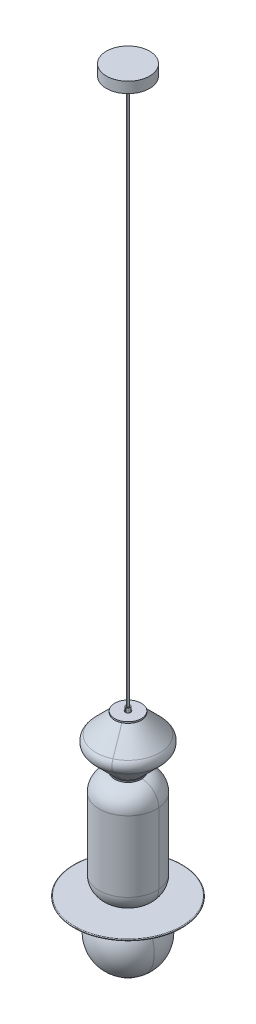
SolidWorks part; units mm, degrees
ref_plane "Alzado" through (0, 0, 0) normal (0, 0, 1) x (1, 0, 0)
ref_plane "Planta" through (0, 0, 0) normal (0, 1, 0) x (1, 0, 0)
ref_plane "Vista lateral" through (0, 0, 0) normal (1, 0, 0) x (0, 0, -1)
imported_body "PAPI_C1233.STEP<1>"
delete or keep bodies "Sólido-Eliminar/Conservar 1" type delete bodies bodies 104
sketch "Croquis2" plane through (0, 1830, 0) normal (0, 1, 0) x (1, 0, 0)
  circle A0 centre (0, 0) radius 59.944
  dimension "D1" = 119.888
extrude "Saliente-Extruir1" add sketch "Croquis2" along normal blind 29.972
